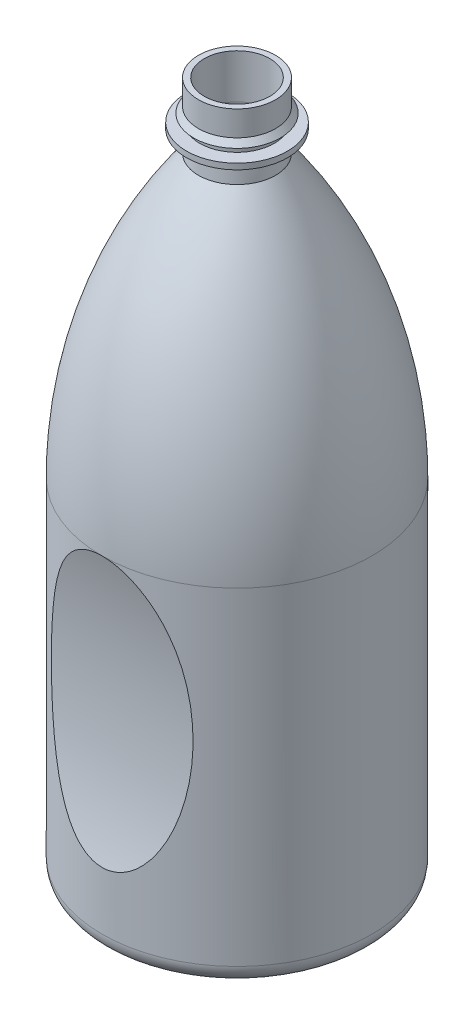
SolidWorks part; units mm, degrees
ref_plane "Front Plane" through (0, 0, 0) normal (0, 0, 1) x (1, 0, 0)
ref_plane "Top Plane" through (0, 0, 0) normal (0, 1, 0) x (1, 0, 0)
ref_plane "Right Plane" through (0, 0, 0) normal (1, 0, 0) x (0, 0, -1)
sketch "Sketch1" plane through (0, 0, 0) normal (1, 0, 0) x (0, 0, -1)
  line L0 (0, 0) -> (0, 70) construction
  line L1 (0, 70) -> (10, 70)
  line L2 (10, 70) -> (10, 63.5)
  line L3 (9.6508, 60) -> (13.0984, 60)
  line L4 (13.0984, 60) -> (13.0984, 58.5)
  line L5 (13.0984, 58.5) -> (9.5984, 58.5)
  line L6 (9.5984, 58.5) -> (7.8192, 7.5509)
  line L7 (10, 63.5) -> (11.2206, 62)
  line L8 (11.2206, 62) -> (9.7206, 62)
  line L9 (9.7206, 62) -> (9.6508, 60)
  line L10 (9.7206, 62) -> (9.6508, 60)
  line L11 (0, 0) -> (-9.6409, 0) construction
  arc A0 (7.8192, 7.5509) -> (0, 0) centre (0, 7.824) cw
  dimension "D1" = 70
  dimension "D2" = 10
  dimension "D3" = 2
  dimension "D4" = 1.5
  dimension "D5" = 3.5
  dimension "D6" = 10
  dimension "D7" = 2
  dimension "D8" = 1.5
  dimension "D9" = 1.5
  dimension "D11" = 90
  dimension "D12" = 9.7206
sketch "Sketch2" plane through (0, 0, 0) normal (1, 0, 0) x (0, 0, -1)
  line L0 (0, 0) -> (0, 70) construction
  line L1 (9.6508, 60) -> (13.0984, 60) construction
  line L2 (13.0984, 60) -> (13.0984, 58.5) construction
  line L3 (13.0984, 58.5) -> (9.5984, 58.5) construction
  line L4 (9.5984, 58.5) -> (7.8192, 7.5509) construction
  line L5 (9.7206, 62) -> (9.6508, 60) construction
  line L6 (0, 70) -> (10, 70) construction
  line L7 (10, 70) -> (10, 63.5) construction
  line L8 (10, 63.5) -> (11.2206, 62) construction
  line L9 (11.2206, 62) -> (9.7206, 62) construction
  line L10 (0, 0) -> (0, 70) construction
  line L11 (9.6508, 60) -> (13.0984, 60)
  line L12 (13.0984, 60) -> (13.0984, 58.5)
  line L13 (13.0984, 58.5) -> (9.5984, 58.5)
  line L14 (9.5984, 58.5) -> (7.8192, 7.5509)
  line L15 (9.7206, 62) -> (9.6508, 60)
  line L16 (0, 70) -> (10, 70) construction
  line L17 (10, 70) -> (10, 63.5)
  line L18 (10, 63.5) -> (11.2206, 62)
  line L19 (11.2206, 62) -> (9.7206, 62)
  line L20 (7, 70) -> (7, 60)
  line L21 (7, 70.0524) -> (6.9982, 70)
  line L22 (9.5984, 58.5) -> (0, 58.5) construction
  line L23 (6.5966, 58.5) -> (4.8211, 7.6556)
  line L24 (7, 60) -> (6.5966, 58.5)
  line L25 (10, 70) -> (6.9982, 70)
  line L26 (0, 3) -> (0, 0)
  arc A0 (0, 0) -> (7.8192, 7.5509) centre (0, 7.824) ccw construction
  arc A1 (0, 0) -> (7.8192, 7.5509) centre (0, 7.824) ccw
  arc A2 (4.8211, 7.6556) -> (0, 3) centre (0, 7.824) cw
  dimension "D1" = 3
  dimension "D2" = 3
  dimension "D3" = 3
  dimension "D4" = 1.5
sketch "Sketch3" plane through (0, 0, 0) normal (1, 0, 0) x (0, 0, -1)
  line L0 (0, 53) -> (0, -106)
  line L1 (0, -106) -> (-35.2901, -106) construction
  line L2 (25, -110) -> (35, -110)
  line L9 (0, 70) -> (10, 70) construction
  line L18 (10, 53) -> (0, 53)
  line L19 (35, -20) -> (35, -110)
  line L20 (35, -110) -> (0, -110) construction
  arc A0 (10, 53) -> (35, -20) centre (-84.08, -20) cw
  arc A1 (25, -110) -> (0, -106) centre (0, -186.125) ccw
  dimension "D4" = 17
  dimension "D5" = 10
  dimension "D6" = 4
  dimension "D1" = 180
  dimension "D2" = 35
  dimension "D3" = 90
  dimension "D7" = 25
revolve "Revolve2" add sketch "Sketch3" angle 360 about L0
fillet "Fillet1" radius 5 1 edges at (0, -110, 35)
sketch "Sketch4" plane through (0, 0, 0) normal (1, 0, 0) x (0, 0, -1)
  line L0 (0, 0) -> (0, -118.2469) construction
  line L1 (35, -105) -> (35, -20) construction
  arc A0 (35, -20) -> (35, -90) centre (149.7824, -55) ccw
  dimension "D1" = 20
  dimension "D3" = 120
  dimension "D2" = 70
extrude "Cut-Extrude1" cut sketch "Sketch4" against normal through all both and the other way through all
mirror "Mirror1" about plane through (0, 0, 0) normal (0, 0, 1) of "Cut-Extrude1"
shell "Shell1" thickness 0.5
sketch "Sketch5" plane through (0, 0, 0) normal (1, 0, 0) x (0, 0, -1)
  line L0 (13.0984, 60) -> (13.0984, 58.5) construction
  line L1 (9.6508, 60) -> (13.0984, 60) construction
  line L2 (13.0984, 58.5) -> (9.5984, 58.5) construction
  line L3 (9.7206, 62) -> (9.6508, 60) construction
  line L4 (11.2206, 62) -> (9.7206, 62) construction
  line L5 (10, 63.5) -> (11.2206, 62) construction
  line L6 (10, 70) -> (10, 63.5) construction
  line L8 (13.0984, 60) -> (13.0984, 58.5)
  line L9 (9.6508, 60) -> (13.0984, 60)
  line L10 (13.0984, 58.5) -> (9.5984, 58.5)
  line L11 (9.7206, 62) -> (9.6508, 60)
  line L12 (11.2206, 62) -> (9.7206, 62)
  line L13 (10, 63.5) -> (11.2206, 62)
  line L14 (10, 70) -> (10, 63.5)
  line L15 (10, 70) -> (8.5, 70)
  line L16 (8.5, 70) -> (8.5, 58.5)
  line L18 (9.5984, 58.5) -> (10, 53)
  line L20 (9.5984, 58.5) -> (0, 58.5) construction
  line L21 (10, 53) -> (-10, 53) construction
  line L22 (9.3663, 53) -> (-9.3663, 53) construction
  line L23 (0, 70.1912) -> (0, 58.5) construction
  line L24 (9.3609, 53) -> (10, 53)
  arc A0 (9.3609, 53) -> (8.5, 58.5) centre (26.5, 58.5) cw
  dimension "D2" = 18
  dimension "D1" = 1.5
revolve "Revolve3" add sketch "Sketch5" angle 360 about L23
sketch "Sketch6" plane through (0, 0, 0) normal (0, 0, 1) x (1, 0, 0)
  line L1 (-60, 125) -> (60, 125)
  line L2 (-60, 125) -> (-60, -125)
  line L3 (-60, -125) -> (60, -125)
  line L4 (60, 125) -> (60, -125)
  line L5 (-60, 125) -> (60, -125) construction
  line L6 (-60, -125) -> (60, 125) construction
  point P0 (0, 0)
  dimension "D1" = 120
  dimension "D2" = 250
